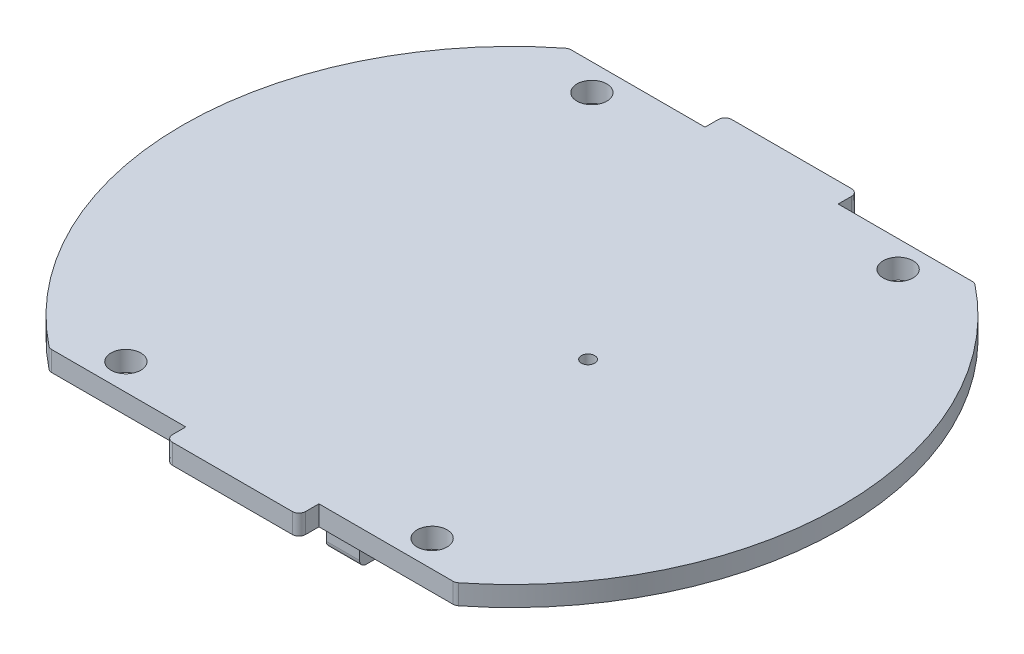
SolidWorks part; units mm, degrees
other "<a_base_t42>-<#8 Clearance Hole1>"
ref_plane "Front Plane" through (0, 0, 0) normal (0, 0, 1) x (1, 0, 0)
ref_plane "Top Plane" through (0, 0, 0) normal (0, 1, 0) x (1, 0, 0)
ref_plane "Right Plane" through (0, 0, 0) normal (1, 0, 0) x (0, 0, -1)
inserted part "a_base_t42"
sketch "Sketch1" plane through (0, 0, 0) normal (0, -1, 0) x (1, 0, 0)
  line L0 (30.4836, 39) -> (-30.4836, 39)
  line L1 (-30.4836, -39) -> (30.4836, -39)
  line L2 (31.5, 42) -> (-31.5, 42)
  line L3 (-31.5, -42) -> (31.5, -42)
  line L4 (31.5, 42) -> (-31.5, 42)
  line L5 (-31.5, -42) -> (31.5, -42)
  arc A0 (-30.4836, 39) -> (-30.4836, -39) centre (0, 0) ccw
  arc A1 (30.4836, -39) -> (30.4836, 39) centre (0, 0) ccw
  arc A2 (31.5, -42) -> (31.5, 42) centre (0, 0) ccw
  arc A3 (-31.5, 42) -> (-31.5, -42) centre (0, 0) ccw
  arc A4 (31.5, -42) -> (31.5, 42) centre (0, 0) ccw
  arc A5 (-31.5, 42) -> (-31.5, -42) centre (0, 0) ccw
  dimension "D1" = 0
  dimension "D2" = 3
extrude "Outer Rim Cut" cut sketch "Sketch1" against normal through all
sketch "Sketch2" plane through (0, 0, 0) normal (0, -1, 0) x (1, 0, 0)
  line L0 (0, 39) -> (0, 0) construction
  line L1 (30.4836, 39) -> (-30.4836, 39) construction
  line L2 (0, 0) -> (49.5, 0) construction
  line L3 (-10, -39) -> (-10, -42)
  line L4 (-10, 39) -> (10, 39)
  line L5 (-10, 39) -> (-10, 42)
  line L6 (-10, 42) -> (10, 42)
  line L7 (10, 39) -> (10, 42)
  line L8 (-10, -39) -> (10, -39)
  line L9 (10, -39) -> (10, -42)
  line L10 (-10, -42) -> (10, -42)
  arc A0 (30.4836, -39) -> (30.4836, 39) centre (0, 0) ccw construction
  dimension "D1" = 20
  dimension "D2" = 3
extrude "Flanges" add sketch "Sketch2" against normal up to surface (3 mm away)
fillet "Contouring" radius 1 8 edges at (30.4836, 1.5, -39) (-30.4836, 1.5, -39) (10, 1.5, -42) (-10, 1.5, -42) (30.4836, 1.5, 39) (-30.4836, 1.5, 39) (10, 1.5, 42) (-10, 1.5, 42)
sketch "Sketch9" plane through (0, 0, 0) normal (0, -1, 0) x (1, 0, 0)
  line L0 (0, 0) -> (11.425, 0) construction
  circle A0 centre (11.425, 0) radius 1
  dimension "D2" = 2
  dimension "D1" = 11.425
extrude "Single Tendon Port" cut sketch "Sketch9" against normal through all
sketch "Sketch3" plane through (0, 0, 0) normal (0, -1, 0) x (1, 0, 0)
  line L0 (0, 42) -> (0, 0) construction
  line L1 (9, 42) -> (-9, 42) construction
  line L2 (0, 0) -> (49.5, 0) construction
  line L3 (-32.825, -28.5) -> (-32.825, -25.5)
  line L4 (-32.825, 28.5) -> (-17.825, 28.5)
  line L5 (-32.825, 28.5) -> (-32.825, 25.5)
  line L6 (-32.825, 25.5) -> (-17.825, 25.5)
  line L7 (-17.825, 28.5) -> (-17.825, 25.5)
  line L8 (-32.825, -28.5) -> (-17.825, -28.5)
  line L9 (-17.825, -28.5) -> (-17.825, -25.5)
  line L10 (-32.825, -25.5) -> (-17.825, -25.5)
  line L11 (-35.825, -20) -> (-35.825, -5)
  line L12 (-32.825, 20) -> (-35.825, 20)
  line L13 (-32.825, 20) -> (-32.825, 5)
  line L14 (-32.825, 5) -> (-35.825, 5)
  line L15 (-35.825, 20) -> (-35.825, 5)
  line L16 (-32.825, -5) -> (-35.825, -5)
  line L17 (-32.825, -20) -> (-32.825, -5)
  line L18 (-32.825, -20) -> (-35.825, -20)
  arc A0 (30.7586, -38.7835) -> (30.7586, 38.7835) centre (0, 0) ccw construction
  circle A3 centre (11.425, 0) radius 1 construction
  dimension "D1" = 15
  dimension "D2" = 3
  dimension "D3" = 25.5
  dimension "D4" = 10
  dimension "D5" = 44.25
extrude "Base Supports" add sketch "Sketch3" along normal blind 3
chamfer "Base Supports Chamfer" distance 3 angle 45 12 edges at (-32.825, -1.5, 28.5) (-25.325, 0, 28.5) (-17.825, -1.5, 28.5) (-25.325, 0, -28.5) (-32.825, -1.5, -28.5) (-17.825, -1.5, -28.5) (-35.825, 0, 12.5) (-35.825, -1.5, 20) (-35.825, -1.5, 5) (-35.825, -1.5, -20) (-35.825, 0, -12.5) (-35.825, -1.5, -5)
sketch "Sketch10" plane through (0, 0, 0) normal (0, -1, 0) x (1, 0, 0)
  circle A0 centre (-40.25, 0) radius 1 construction
  circle A1 centre (40.25, 0) radius 1 construction
  circle A2 centre (-40.25, 0) radius 1
  circle A3 centre (40.25, 0) radius 1
extrude "Cover" add sketch "Sketch10" against normal up to surface (3 mm away)
ref_point "Point1"
sketch "Sketch4" [suppressed] plane through (0, 0, 0) normal (0, -1, 0) x (1, 0, 0)
  line L0 (0, 42) -> (0, 0) construction
  line L1 (9, 42) -> (-9, 42) construction
  line L2 (0, 0) -> (-49.5, 0) construction
  line L4 (2.175, 22.5) -> (5.175, 22.5)
  line L5 (2.175, 22.5) -> (2.175, -22.5)
  line L6 (2.175, -22.5) -> (5.175, -22.5)
  line L7 (5.175, 22.5) -> (5.175, -22.5)
  line L12 (-32.825, 28.5) -> (-32.825, 25.5) construction
  arc A0 (-30.7586, 38.7835) -> (-30.7586, -38.7835) centre (0, 0) ccw construction
  circle A1 centre (11.425, 0) radius 1 construction
  dimension "D1" = 45
  dimension "D2" = 6.25
extrude "Dynamixel Side Supports" [suppressed] add sketch "Sketch4" along normal blind 6.85
sketch "Sketch5" [suppressed] plane through (0, 0, 0) normal (0, -1, 0) x (1, 0, 0)
  line L0 (2.175, -22.5) -> (5.175, -22.5) construction
  line L5 (5.175, -22.5) -> (-6.825, -22.5)
  line L6 (5.175, -22.5) -> (5.175, -25.5)
  line L7 (5.175, -25.5) -> (-6.825, -25.5)
  line L8 (-6.825, -22.5) -> (-6.825, -25.5)
  dimension "D1" = 12
extrude "Dynamixel Side Support Ends" [suppressed] add sketch "Sketch5" along normal blind 9.85
sketch "Sketch8" [suppressed] plane through (0, 0, 0) normal (0, -1, 0) x (1, 0, 0)
  line L0 (0, 42) -> (0, 0) construction
  line L2 (-6.825, -22.5) -> (2.175, -22.5)
  line L3 (-6.825, -22.5) -> (-6.825, 22.5)
  line L4 (-6.825, 22.5) -> (2.175, 22.5)
  line L5 (9, 42) -> (-9, 42) construction
  line L6 (2.175, -22.5) -> (2.175, 22.5)
extrude "Dynamixel Offset" [suppressed] add sketch "Sketch8" along normal blind 1.25
fillet "Dynamixel Contouring" [suppressed] radius 1
sketch "Sketch6" plane through (0, 0, 0) normal (0, -1, 0) x (1, 0, 0)
  line L0 (0, 42) -> (0, 0) construction
  line L1 (9, 42) -> (-9, 42) construction
  line L2 (0, 0) -> (-49.5, 0) construction
  line L4 (-0.075, 27.82) -> (4.925, 27.82)
  line L5 (-0.075, 27.82) -> (-0.075, -27.82)
  line L6 (-0.075, -27.82) -> (4.925, -27.82)
  line L7 (4.925, 27.82) -> (4.925, -27.82)
  arc A0 (-30.7586, 38.7835) -> (-30.7586, -38.7835) centre (0, 0) ccw construction
  circle A1 centre (11.425, 0) radius 1 construction
  dimension "D1" = 5
  dimension "D2" = 6.5
  dimension "D3" = 55.64
extrude "Servo Side Supports" add sketch "Sketch6" along normal blind 8.5
sketch "Sketch7" plane through (0, -8.5, 0) normal (0, -1, 0) x (1, 0, 0)
  line L0 (4.925, -27.82) -> (4.925, 27.82) construction
  line L1 (-0.075, 27.82) -> (4.925, 27.82)
  line L2 (-0.075, 27.82) -> (-0.075, 20)
  line L3 (-0.075, 20) -> (4.925, 20)
  line L4 (4.925, 27.82) -> (4.925, 20)
  line L5 (-62.1115, 0) -> (0, 0) construction
  line L6 (0, 0) -> (0, 52.5269) construction
  line L15 (4.925, -27.82) -> (4.925, -20)
  line L16 (-0.075, -20) -> (4.925, -20)
  line L17 (-0.075, -27.82) -> (-0.075, -20)
  line L18 (-0.075, -27.82) -> (4.925, -27.82)
  dimension "D1" = 40
extrude "Servo Side Support Ends" add sketch "Sketch7" along normal blind 5
fillet "Servo Contouring" radius 1 8 edges at (2.425, 0, -27.82) (2.425, 0, 27.82) (2.425, -13.5, 20) (2.425, -13.5, 27.82) (2.425, -13.5, -27.82) (2.425, -13.5, -20)
equation "\"D2@Sketch1\"=\"width keep@values@params_print.SLDPRT\""
equation "\"D2@Sketch2\"=\"width keep@values@params_print.SLDPRT\""
equation "\"D2@Sketch3\"=\"width keep@values@params_print.SLDPRT\""
equation "\"D1@Base Supports\"=\"width keep@values@params_print.SLDPRT\""
equation "\"D1@Base Supports Chamfer\"=\"width keep@values@params_print.SLDPRT\""
equation "\"D1@Sketch9\"=19.425-\"Rp@values@params_finger_t42.SLDPRT\""
